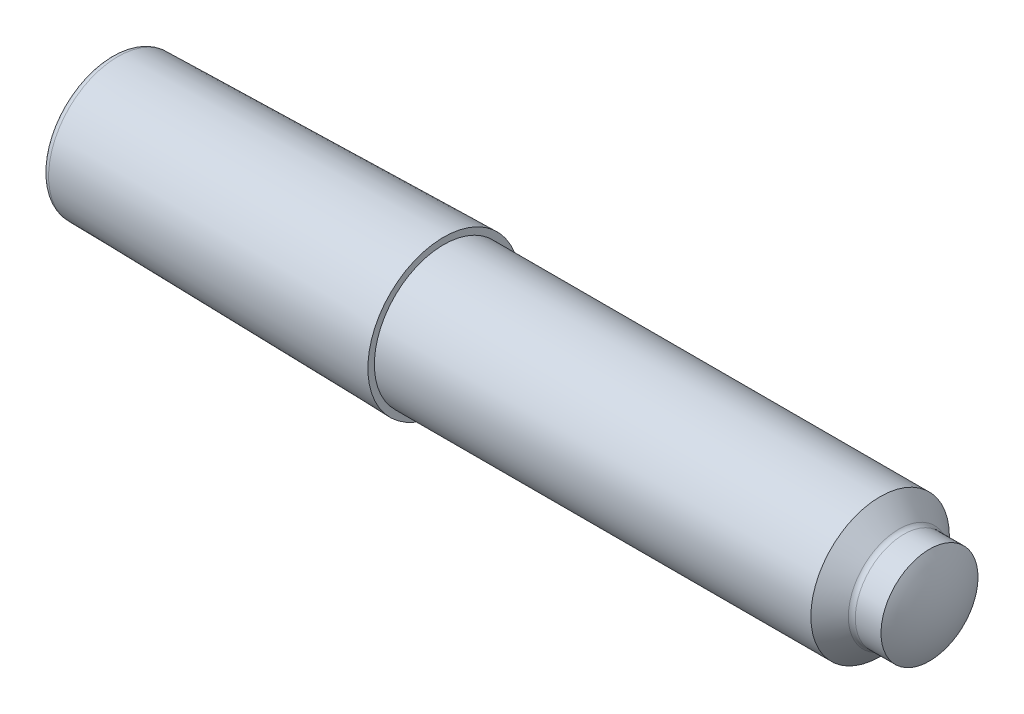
SolidWorks part; units mm, degrees
ref_plane "Front" through (0, 0, 0) normal (0, 0, 1) x (1, 0, 0)
ref_plane "Top" through (0, 0, 0) normal (0, 1, 0) x (1, 0, 0)
ref_plane "Right" through (0, 0, 0) normal (1, 0, 0) x (0, 0, -1)
sketch "Sketch1" plane through (0, 0, 0) normal (0, 0, 1) x (1, 0, 0)
  line L0 (0, 0) -> (0, 2.25)
  line L1 (0.245, 2.5) -> (12, 2.7351)
  line L2 (0, 2.4951) -> (12, 2.4951) construction
  line L3 (14.4, 2.5) -> (27.75, 2.5)
  line L4 (27.75, 2.5) -> (28.5, 1.75)
  line L5 (28.5, 1.75) -> (29.5311, 1.75)
  line L6 (0, 0) -> (-2.8036, 0) construction
  line L7 (0, 0) -> (30, 0)
  line L8 (14.4, 2.5) -> (12, 2.5)
  line L9 (12, 2.5) -> (12, 2.7351)
  line L10 (12, 2.7351) -> (12, 2.4951) construction
  arc A0 (30, 0) -> (29.5311, 1.75) centre (26.5, 0) ccw
  arc A1 (0, 2.25) -> (0.245, 2.5) centre (0.25, 2.25) cw
  dimension "r" = 3.5
  dimension "D11" = 0.25
  dimension "d1" = 5
  dimension "d2" = 5
  dimension "D4" = 0.24
  dimension "d3" = 3.5
  dimension "l" = 30
  dimension "D6" = 1.5
  dimension "b" = 15.6
  dimension "D8" = 45
  dimension "a" = 2.4
revolve "Body" add sketch "Sketch1" angle 360 about L6
fillet "Fillet1" radius 0.25 1 edges at (28.5, 0, -1.75)
sketch "Sketch2" plane through (0, 0, 0) normal (0, 0, 1) x (1, 0, 0)
  line L0 (27.5, 3) -> (28, 3)
  line L1 (28, 3) -> (28, 2.5)
  line L2 (28, 2.5) -> (27.75, 2.067)
  line L3 (27.75, 2.067) -> (27.5, 2.5)
  line L4 (27.5, 2.5) -> (27.5, 3)
  line L5 (0, 0) -> (44.52, 0) construction
  line L6 (27.75, 2.5) -> (12, 2.5) construction
  line L11 (27.75, 2.5) -> (27.75, -2.5) construction
  dimension "D1" = 0.5
revolve "Cut-Revolve10" [suppressed] cut sketch "Sketch2" angle 360 about L5
pattern_linear "LPattern10" [suppressed] count 22 spacing 0.6 along (1, 0, 0)
equation "\"r@Sketch1\" =  \"d3@Sketch1\""
equation "\"D4@Sketch1\" = (  \"l@Sketch1\" - \"b@Sketch1\" - \"a@Sketch1\" )  / 50"
equation "\"D11@Sketch1\" = \"d1@Sketch1\" / 20"
equation "\"D1@Fillet1\" = \"D11@Sketch1\""
equation "\"b@ThreadCosmetic1\" = \"b@Sketch1\" - \"D6@Sketch1\" - (  (  \"d2@Sketch1\" - \"d3@Sketch1\" )  / 2 ) "
equation "\"D3@LPattern10\" =\"D1@Sketch2\" * 1.2"
equation "\"D1@LPattern10\" =\"b@ThreadCosmetic1\" / \"D3@LPattern10\""
equation "\"d@ThreadCosmetic1\" = \"d2@Sketch1\" * 4 / 5"
equation "\"D1@Sketch2\" = (  \"d2@Sketch1\" - \"d@ThreadCosmetic1\" )  / 2"
